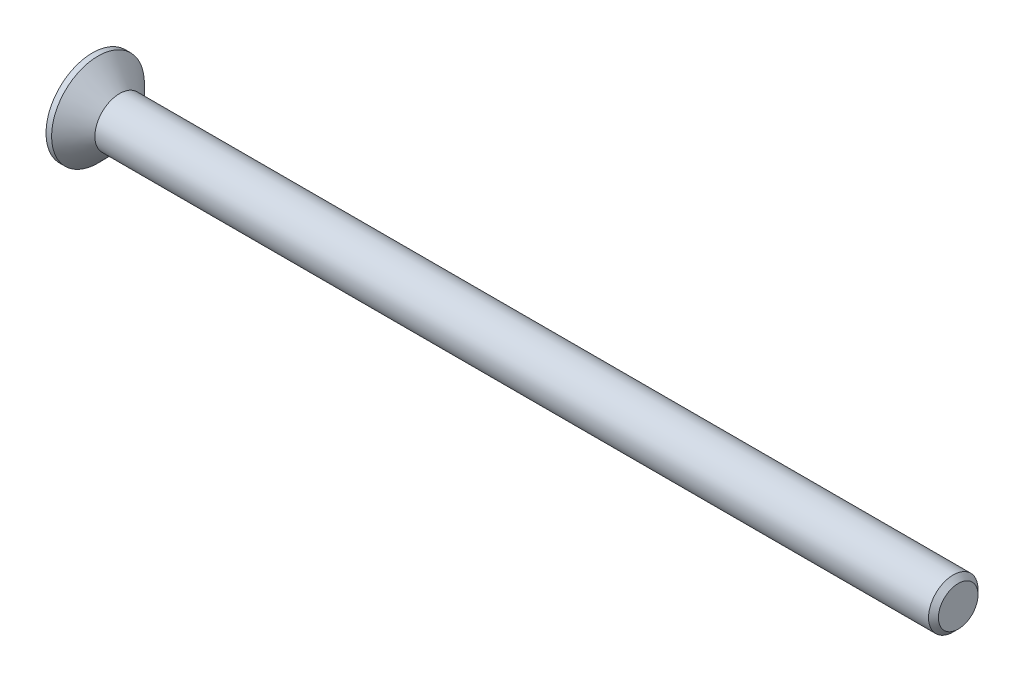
SolidWorks part; units mm, degrees
ref_plane "Front Plane" through (0, 0, 0) normal (0, 0, 1) x (1, 0, 0)
ref_plane "Top Plane" through (0, 0, 0) normal (0, 1, 0) x (1, 0, 0)
ref_plane "Right Plane" through (0, 0, 0) normal (1, 0, 0) x (0, 0, -1)
sketch "Sketch1" plane through (0, 0, 0) normal (0, 0, 1) x (1, 0, 0)
  line L1 (-2.2, 3.75) -> (-2.2, 0)
  line L2 (-2.2, 0) -> (67.8, 0)
  line L3 (67.8, 0) -> (67.8, 2)
  line L4 (67.8, 2) -> (0, 2)
  line L5 (-2.2, 3.75) -> (-1.75, 3.75)
  line L6 (-1.75, 3.75) -> (0, 2)
  dimension "D1" = 2
  dimension "D2" = 45
  dimension "D3" = 2.2
  dimension "D4" = 70
  dimension "D5" = 3.75
revolve "Revolve1" add sketch "Sketch1" angle 360 about L2
chamfer "Chamfer1" distance 0.4 angle 45 1 edges at (67.8, 0, 2)
sketch "Sketch2" plane through (-2.2, 0, 0) normal (-1, 0, 0) x (0, 0, 1)
  line L0 (-0.55, 2.2) -> (0.55, 2.2)
  line L1 (0.55, 2.2) -> (0.55, 0.55)
  line L2 (0.55, 0.55) -> (2.2, 0.55)
  line L3 (2.2, 0.55) -> (2.2, -0.55)
  line L4 (2.2, -0.55) -> (0.55, -0.55)
  line L5 (0.55, -0.55) -> (0.55, -2.2)
  line L6 (0.55, -2.2) -> (-0.55, -2.2)
  line L7 (-0.55, -2.2) -> (-0.55, -0.55)
  line L8 (-0.55, -0.55) -> (-2.2, -0.55)
  line L9 (-2.2, -0.55) -> (-2.2, 0.55)
  line L10 (-2.2, 0.55) -> (-0.55, 0.55)
  line L11 (-0.55, 0.55) -> (-0.55, 2.2)
  point P2 (0, 2.2)
  point P14 (0, -2.2)
  point P15 (2.2, 0)
  point P16 (-2.2, 0)
  dimension "D1" = 4.4
  dimension "D2" = 1.1
extrude "Cut-Extrude1" cut sketch "Sketch2" against normal blind 1.9
